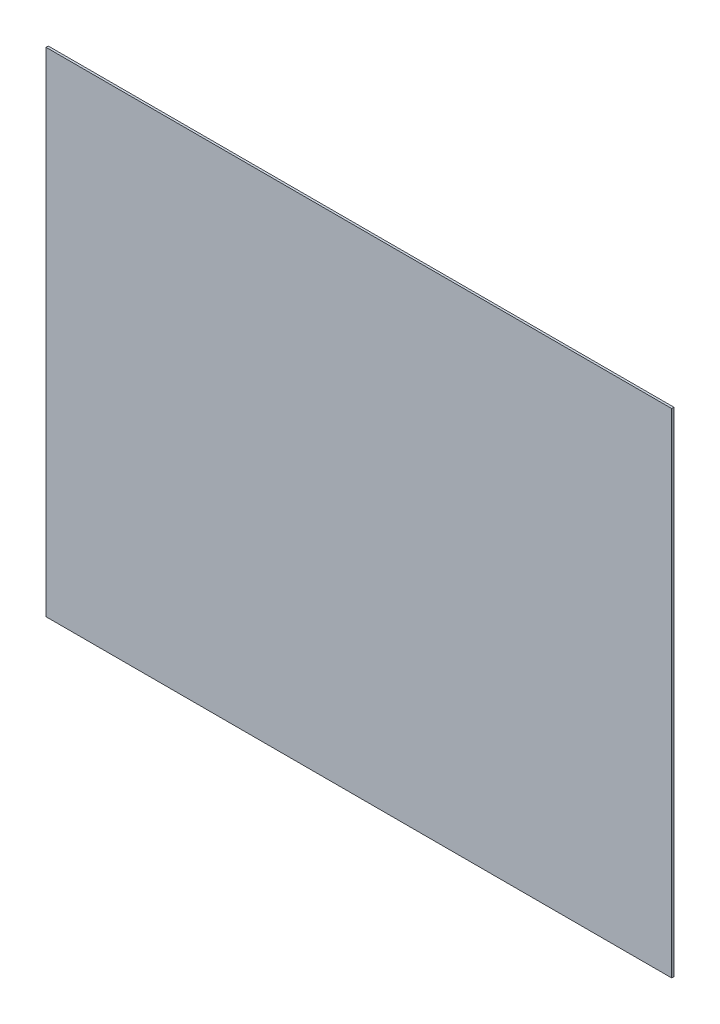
SolidWorks part; units mm, degrees
ref_plane "Front Plane" through (0, 0, 0) normal (1, 0, 0) x (0, 1, 0)
ref_plane "Top Plane" through (0, 0, 0) normal (0, 0, 1) x (0, 1, 0)
ref_plane "Right Plane" through (0, 0, 0) normal (0, 1, 0) x (-1, 0, 0)
sketch "Sketch1" plane through (0, 0, 0) normal (0, 0, 1) x (0, 1, 0)
  line L1 (-33500, 42500) -> (33500, 42500)
  line L2 (-33500, 42500) -> (-33500, -42500)
  line L3 (-33500, -42500) -> (33500, -42500)
  line L4 (33500, 42500) -> (33500, -42500)
  line L5 (-33500, 42500) -> (33500, -42500) construction
  line L6 (-33500, -42500) -> (33500, 42500) construction
  point P0 (0, 0)
  dimension "D1" = 85000
  dimension "D2" = 67000
extrude "Boss-Extrude1" add sketch "Sketch1" along normal blind 304.8
